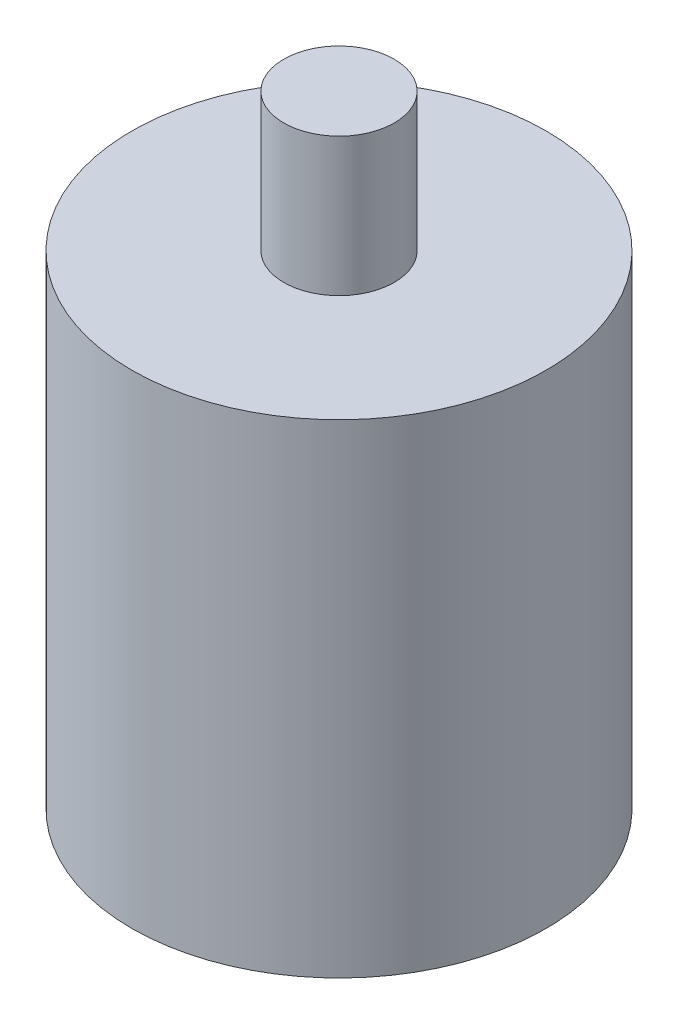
SolidWorks part; units mm, degrees
ref_plane "Plan de face" through (0, 0, 0) normal (0, 0, 1) x (1, 0, 0)
ref_plane "Plan de dessus" through (0, 0, 0) normal (0, 1, 0) x (1, 0, 0)
ref_plane "Plan de droite" through (0, 0, 0) normal (1, 0, 0) x (0, 0, -1)
sketch "Esquisse1" plane through (0, 0, 0) normal (0, 0, 1) x (1, 0, 0)
  line L0 (0, 0) -> (0, 34.1939) construction
  line L1 (-3.25, -35) -> (-3.25, -25)
  line L2 (-3.25, -25) -> (0, -25)
  line L3 (0, -25) -> (0, 10)
  line L4 (0, 10) -> (-4, 10)
  line L5 (-4, 10) -> (-4, 0)
  line L6 (-4, 0) -> (-15, 0)
  line L7 (-15, 0) -> (-15, -35)
  line L8 (-15, -35) -> (-3.25, -35)
  dimension "D1" = 30
  dimension "D2" = 6.5
  dimension "D3" = 8
  dimension "D4" = 35
  dimension "D5" = 10
  dimension "D6" = 10
revolve "Révolution1" add sketch "Esquisse1" angle 360 about L0
thread "Filetage1" pitch 1.25 start angle 0, offset 0, length 0, pitch 1.25, diameter 6.5
ref_plane "Plan1" through (3.25, -35, 0) normal (0, 0, 1) x (1, 0, 0)
sketch "Profil de filetage1" plane through (3.25, -35, 0) normal (0, 0, 1) x (1, 0, 0)
  line L0 (0, 0) -> (0, 1.25) construction
  line L1 (0, 0) -> (0.6766, 0.3906)
  line L2 (0.6766, 0.3906) -> (0.6766, 0.5469)
  line L3 (0.6766, 0.5469) -> (0, 0.9375)
  line L4 (0.6766, 0.4687) -> (0, 0.4687) construction
  line L11 (0, 0) -> (0, 0.9375)
  point P2 (0, 0)
  dimension "Pitch" = 1.25
  dimension "Profile_Angle" = 60
  dimension "Profile_Land" = 0.1562
  dimension "Profile_Height" = 0.6766
